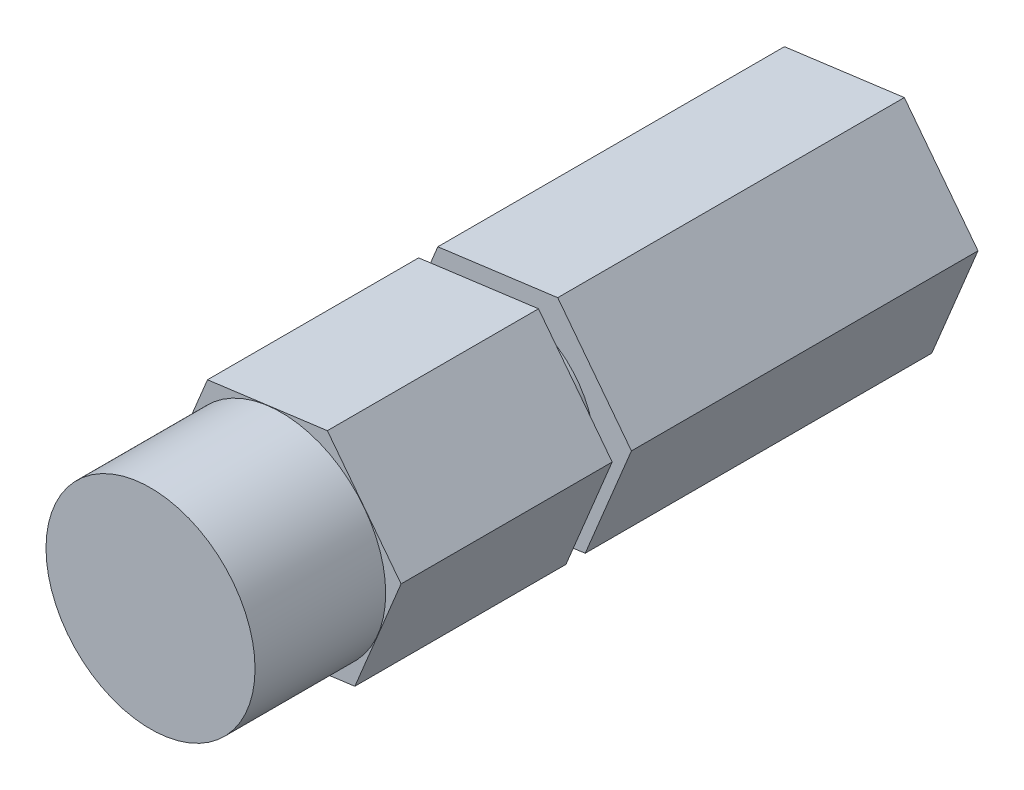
SolidWorks part; units mm, degrees
ref_plane "Front Plane" through (0, 0, 0) normal (0, 0, 1) x (1, 0, 0)
ref_plane "Top Plane" through (0, 0, 0) normal (0, 1, 0) x (1, 0, 0)
ref_plane "Right Plane" through (0, 0, 0) normal (1, 0, 0) x (0, 0, -1)
sketch "Sketch1" plane through (0, 0, 0) normal (1, 0, 0) x (0, 0, -1)
  line L0 (0, 0) -> (5184.742, 0) construction
  line L1 (0, 0) -> (0, 6.35)
  line L2 (0, 6.35) -> (7.9375, 6.35)
  line L3 (7.9375, 6.35) -> (7.9375, 6.3627)
  line L4 (7.9375, 6.3627) -> (42.9895, 6.3627)
  line L5 (42.9895, 6.3627) -> (42.9895, 0)
  line L6 (0, 0) -> (42.9895, 0)
  dimension "D1" = 7.9375
  dimension "D2" = 35.052
  dimension "D3" = 12.7254
  dimension "D4" = 12.7
revolve "Revolve1" add sketch "Sketch1" angle 360 about L0
sketch "Sketch2" plane through (0, 0, -7.9375) normal (0, 0, 1) x (1, 0, 0)
  line L1 (2.8071, 6.7896) -> (-4.4764, 5.8259)
  line L2 (-4.4764, 5.8259) -> (-7.2835, -0.9637)
  line L3 (-7.2835, -0.9637) -> (-2.8071, -6.7896)
  line L4 (-2.8071, -6.7896) -> (4.4764, -5.8259)
  line L5 (4.4764, -5.8259) -> (7.2835, 0.9637)
  line L6 (7.2835, 0.9637) -> (2.8071, 6.7896)
  circle A0 centre (0, 0) radius 6.3627 construction
  circle A1 centre (0, 0) radius 6.3627 construction
extrude "Boss-Extrude1" add sketch "Sketch2" against normal up to surface (35.052 mm away)
hole_wizard "Tap Drill for #10-32 Tap1" positions "3DSketch1" profile "Sketch4" hole size "#10-32" standard "ANSI Inch"
sketch3d "3DSketch1"
  line L0 (-2.8071, -6.7896, -42.9895) -> (2.8071, 6.7896, -42.9895) construction
  point P0 (0, 0, -42.9895)
  point P8 (0, 0, -42.9895)
sketch "Sketch4" plane through (0, 0, -42.9895) normal (1, 0, 0) x (0, 1, 0)
  line L0 (0, 0) -> (0, 13.9133)
  line L1 (0, 13.9133) -> (2.0193, 12.7)
  line L2 (2.0193, 12.7) -> (2.0193, 0)
  line L5 (2.0193, 0) -> (0, 0)
  line L10 (0, 13.9133) -> (-2.0193, 12.7) construction
  line L11 (0, -6.35) -> (0, 107.95) construction
  dimension "Hole Dia." = 4.0386
  dimension "Hole Depth" = 12.7
  dimension "Drill Angle" = 118
sketch "Sketch5" plane through (0, 0, 0) normal (0, 1, 0) x (1, 0, 0)
  line L1 (9.3851, 20.7645) -> (5.0292, 20.7645)
  line L2 (9.3851, 20.7645) -> (9.3851, 21.9329)
  line L3 (9.3851, 21.9329) -> (5.0292, 21.9329)
  line L4 (5.0292, 20.7645) -> (5.0292, 21.9329)
  line L5 (-6.35, 0) -> (6.35, 0) construction
  line L6 (0, 0) -> (0, 4.8344) construction
  dimension "D1" = 20.7645
  dimension "D2" = 5.0292
  dimension "D3" = 1.1684
revolve "Cut-Revolve1" cut sketch "Sketch5" angle 360 about L6
